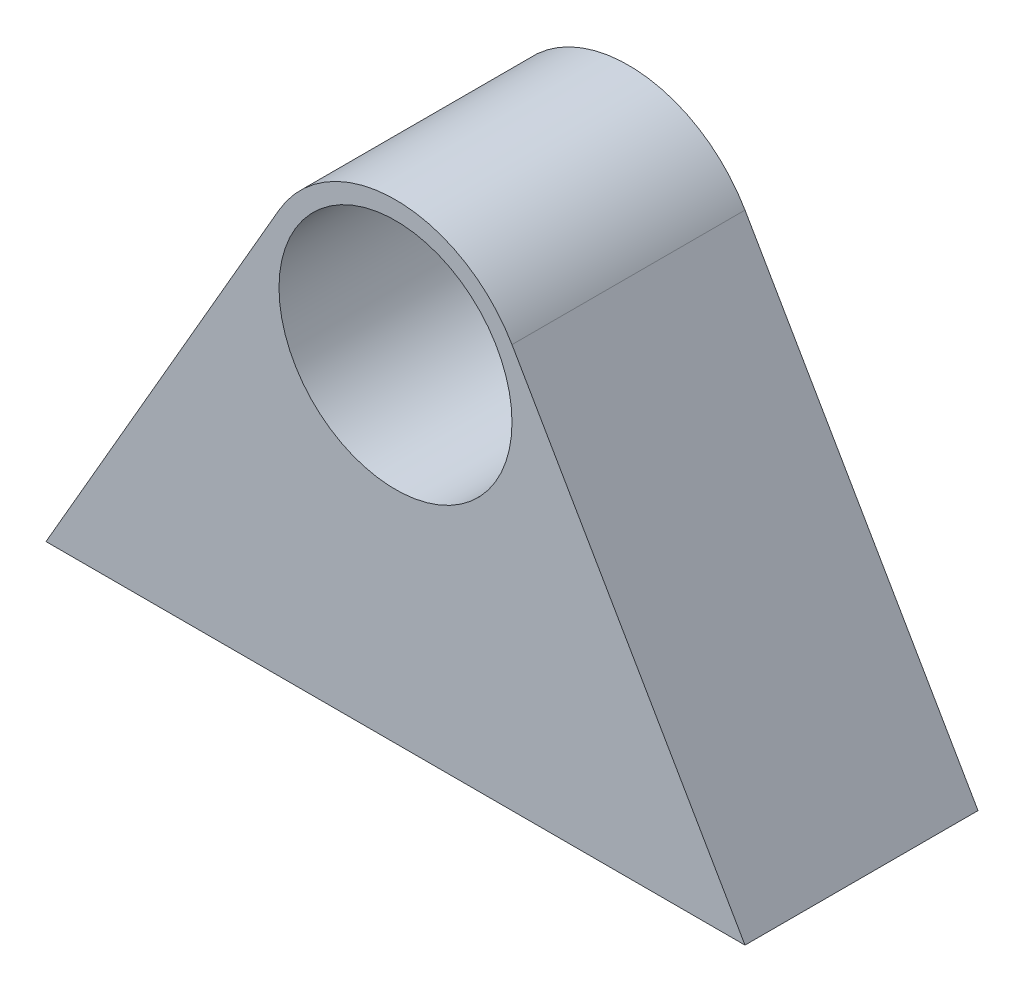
SolidWorks part; units mm, degrees
ref_plane "Front Plane" through (0, 0, 0) normal (0, 0, 1) x (1, 0, 0)
ref_plane "Top Plane" through (0, 0, 0) normal (0, 1, 0) x (1, 0, 0)
ref_plane "Right Plane" through (0, 0, 0) normal (1, 0, 0) x (0, 0, -1)
sketch "Sketch1" plane through (0, 0, 0) normal (0, 0, 1) x (1, 0, 0)
  line L0 (0, 0) -> (10, 17.3205)
  line L1 (20, 17.3205) -> (30, 0)
  line L2 (30, 0) -> (0, 0)
  arc A0 (10, 17.3205) -> (20, 17.3205) centre (15, 14.4338) cw
  dimension "D1" = 60
  dimension "D2" = 60
  dimension "D3" = 30
  dimension "D4" = 20
extrude "Boss-Extrude1" add sketch "Sketch1" along normal blind 10
sketch "Sketch2" plane through (0, 0, 10) normal (0, 0, 1) x (1, 0, 0)
  circle A0 centre (15, 14.4338) radius 5
  arc A1 (20, 17.3205) -> (10, 17.3205) centre (15, 14.4338) ccw construction
  dimension "D1" = 10
extrude "Cut-Extrude1" cut sketch "Sketch2" against normal through all
